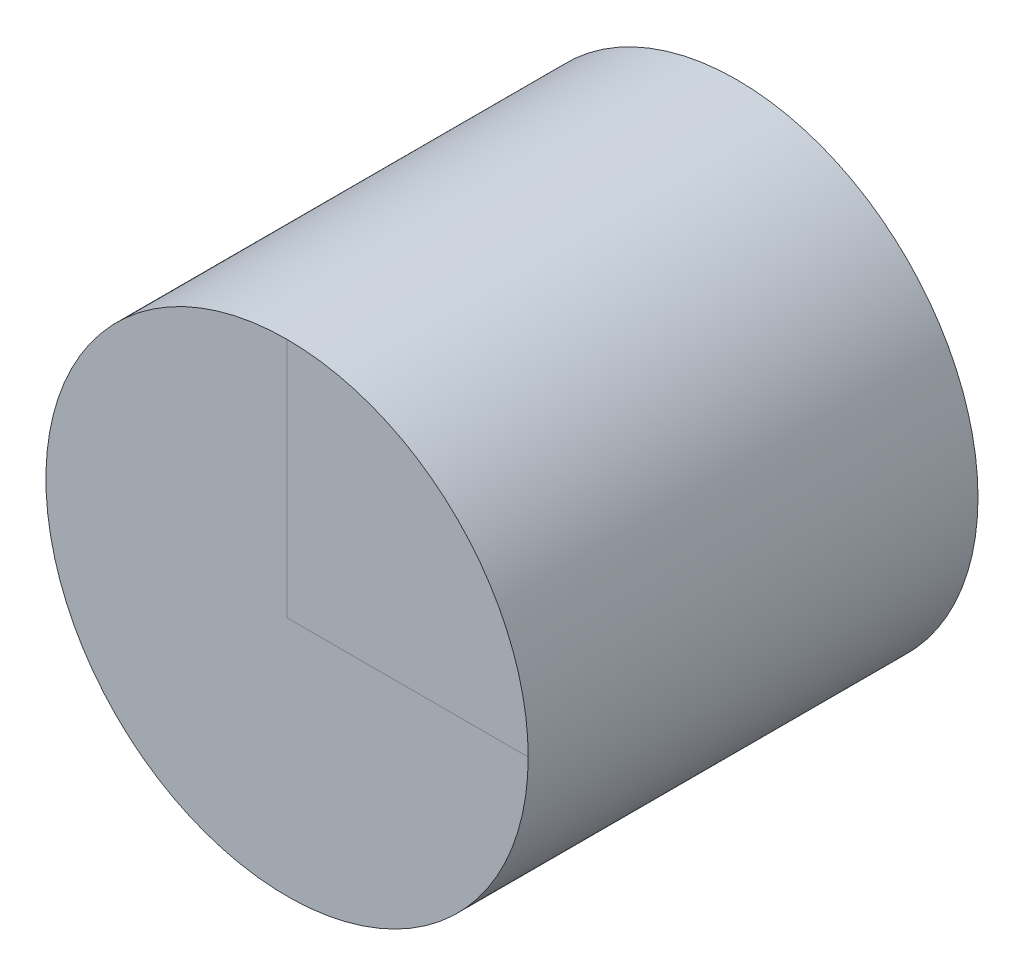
SolidWorks part; units mm, degrees
ref_plane "Front Plane" through (0, 0, 0) normal (0, 0, 1) x (1, 0, 0)
ref_plane "Top Plane" through (0, 0, 0) normal (0, 1, 0) x (1, 0, 0)
ref_plane "Right Plane" through (0, 0, 0) normal (1, 0, 0) x (0, 0, -1)
sketch "Sketch1" plane through (0, 0, 0) normal (0, 0, 1) x (1, 0, 0)
  circle A0 centre (0, 0) radius 60
  dimension "D1" = 120
extrude "Extrude1" add sketch "Sketch1" along normal blind 111.92
sketch "Sketch2" plane through (0, 0, 111.92) normal (0, 0, 1) x (1, 0, 0)
  line L0 (0, 0) -> (60, 0)
  line L1 (0, 0) -> (0, 60)
  circle A0 centre (0, 0) radius 60 construction
  arc A1 (60, 0) -> (0, 60) centre (0, 0) ccw
